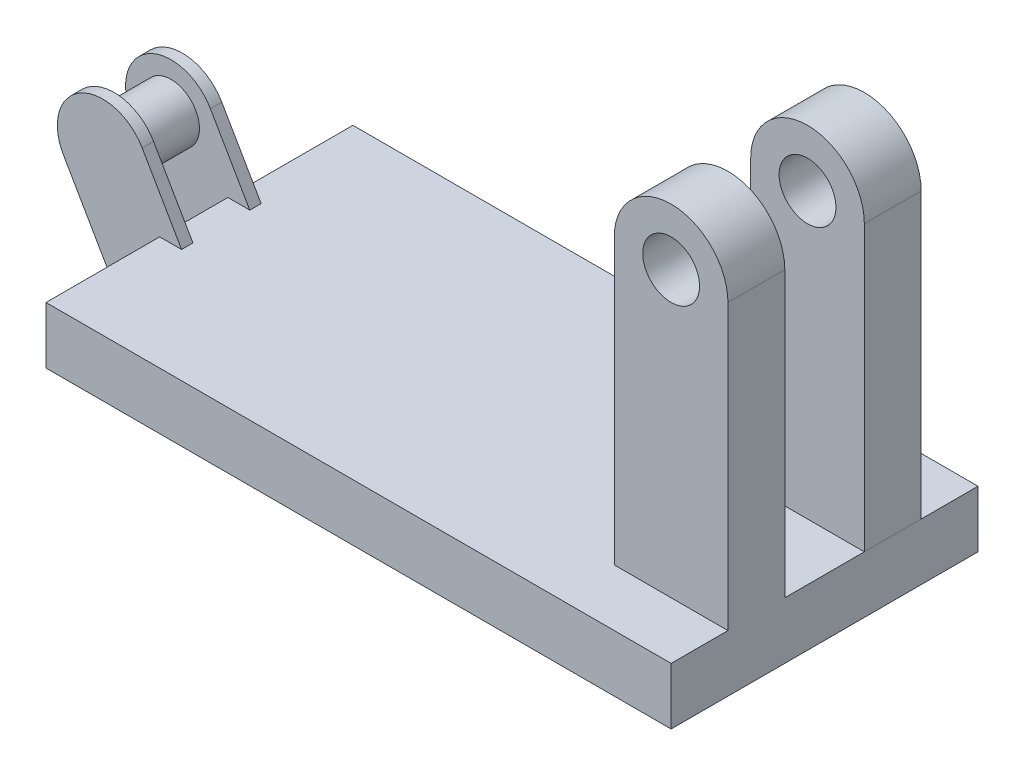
SolidWorks part; units mm, degrees
ref_plane "Ebene vorne" through (0, 0, 0) normal (0, 0, 1) x (1, 0, 0)
ref_plane "Ebene oben" through (0, 0, 0) normal (0, 1, 0) x (1, 0, 0)
ref_plane "Ebene rechts" through (0, 0, 0) normal (1, 0, 0) x (0, 0, -1)
sketch "Skizze1" plane through (0, 0, 0) normal (0, 1, 0) x (1, 0, 0)
  line L0 (275, 135) -> (-275, -135) construction
  line L1 (-275, 135) -> (275, 135)
  line L2 (-275, 135) -> (-275, -135)
  line L3 (-275, -135) -> (275, -135)
  line L4 (275, 135) -> (275, -135)
  line L5 (-275, -135) -> (-275, -136.033) construction
  dimension "D1" = 270
  dimension "D2" = 550
extrude "Linear austragen1" add sketch "Skizze1" along normal blind 50
sketch "Skizze2" plane through (0, 0, 0) normal (0, 0, 1) x (1, 0, 0)
  line L0 (-275, 50) -> (275, 50) construction
  line L1 (175, 50) -> (175, 300)
  line L2 (275, 300) -> (275, 50)
  line L3 (275, 50) -> (175, 50)
  line L5 (-275, 50) -> (-275, 0) construction
  circle A0 centre (225, 300) radius 25
  arc A1 (275, 300) -> (175, 300) centre (225, 300) ccw
  dimension "D1" = 250
  dimension "D2" = 50
  dimension "D3" = 100
  dimension "D4" = 500
extrude "Linear austragen2" add sketch "Skizze2" along normal blind 50 from offset 35 separate body
mirror "Spiegeln1" about plane through (0, 0, 0) normal (0, 0, 1)
sketch "Skizze3" plane through (0, 0, 0) normal (0, 0, 1) x (1, 0, 0)
  line L0 (-275, 0) -> (275, 0) construction
  line L1 (-275, 50) -> (-275, 0) construction
  circle A0 centre (-325, 90) radius 25
  dimension "D1" = 50
  dimension "D2" = 90
  dimension "D3" = 50
extrude "Linear austragen3" add sketch "Skizze3" along normal mid plane 50 separate body
sketch "Skizze4" plane through (0, 0, 25) normal (0, 0, 1) x (1, 0, 0)
  line L0 (-275, 50) -> (-275, 0) construction
  line L1 (-275, 0) -> (-319.2109, 0)
  line L2 (-319.2109, 0) -> (-359.1093, 69.1061)
  line L3 (-290.359, 110) -> (-255.718, 50)
  line L4 (-275, 50) -> (275, 50) construction
  line L9 (-275, 0) -> (275, 0)
  line L10 (275, 0) -> (275, 50)
  line L11 (275, 50) -> (-275, 50)
  line L12 (-275, 50) -> (-275, 0)
  line L13 (-275, 0) -> (275, 0)
  line L14 (275, 0) -> (275, 50)
  line L15 (275, 50) -> (-255.718, 50)
  arc A0 (-290.359, 110) -> (-359.1093, 69.1061) centre (-325, 90) ccw
  dimension "D1" = 80
  dimension "D2" = 30
  dimension "D3" = 0
extrude "Linear austragen4" add sketch "Skizze4" along normal blind 10
mirror "Spiegeln2" about plane through (0, 0, 0) normal (0, 0, 1) of "Linear austragen4"
